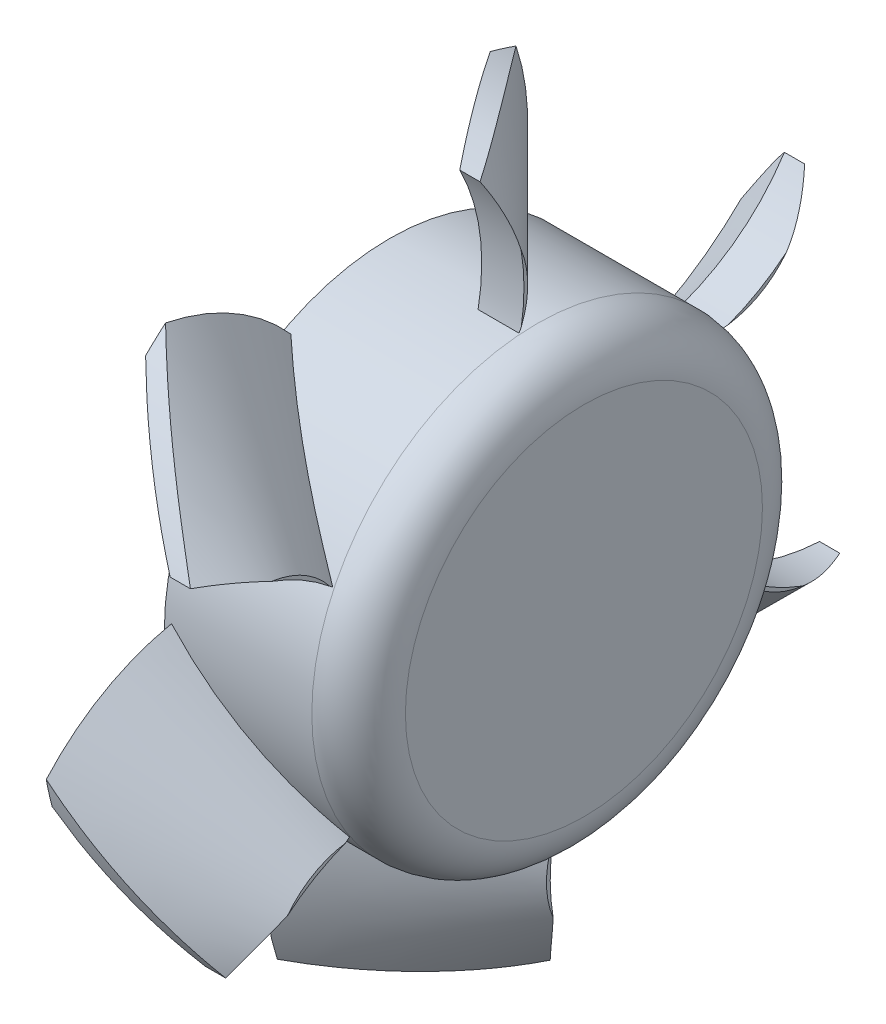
SolidWorks part; units mm, degrees
ref_plane "Front Plane" through (0, 0, 0) normal (0, 0, 1) x (1, 0, 0)
ref_plane "Top Plane" through (0, 0, 0) normal (0, 1, 0) x (1, 0, 0)
ref_plane "Right Plane" through (0, 0, 0) normal (1, 0, 0) x (0, 0, -1)
sketch "Sketch1" plane through (0, 0, 0) normal (1, 0, 0) x (0, 0, -1)
  circle A0 centre (0, 0) radius 12.2301
  dimension "D1" = 24.4602
extrude "Extrude1" add sketch "Sketch1" along normal blind 10.541
fillet "Fillet1" radius 2.54 1 edges at (10.541, 0, -12.2301)
ref_plane "Plane1" through (7.9993, 0, 0) normal (1, 0, 0) x (0, 0, -1)
ref_plane "Plane2" through (0, 12.2301, 0) normal (0, 1, 0) x (-1, 0, 0)
sketch "Sketch4" plane through (7.9993, 0, 0) normal (1, 0, 0) x (0, 0, -1)
  line L0 (0, -19.3421) -> (0, 19.3421) construction
  line L1 (5.715, -19.3421) -> (5.715, -18.4785)
  line L2 (-19.3421, 0) -> (19.3421, 0) construction
  line L3 (5.715, -19.3421) -> (5.715, 19.3421) construction
  arc A0 (-1.905, 19.2481) -> (-0.9111, 12.1961) centre (-11.6721, 14.2754) cw
  arc A1 (-11.0177, 5.3091) -> (-12.2228, 0.4222) centre (0, 0) ccw
  arc A2 (6.477, 18.2254) -> (6.477, 10.3742) centre (-5.3337, 14.2998) cw
  arc A3 (-10.1066, -6.8871) -> (-6.477, -10.3742) centre (0, 0) ccw
  arc A4 (-12.5452, 14.7219) -> (-17.6218, 7.9743) centre (0, 0) ccw
  arc A5 (15.7168, 11.2738) -> (10.1066, 6.8871) centre (6.5268, 17.2461) cw
  arc A6 (19.0222, 3.5035) -> (12.2228, -0.4222) centre (9.7171, 11.769) cw
  arc A7 (17.6218, -7.9743) -> (11.0177, -5.3091) centre (18.1989, 2.9706) cw
  arc A8 (12.5452, -14.7219) -> (5.7458, -10.7963) centre (15.0508, -2.5308) cw
  arc A9 (1.905, -19.2481) -> (0.9111, -12.1961) centre (11.6721, -14.2754) cw
  arc A10 (-6.477, -18.2254) -> (-6.477, -10.3742) centre (5.3337, -14.2998) cw
  arc A11 (-15.7168, -11.2738) -> (-10.1066, -6.8871) centre (-6.5268, -17.2461) cw
  arc A12 (-19.0222, -3.5035) -> (-12.2228, 0.4222) centre (-9.7171, -11.769) cw
  arc A13 (-17.6218, 7.9743) -> (-11.0177, 5.3091) centre (-18.1989, -2.9706) cw
  arc A14 (-12.5452, 14.7219) -> (-5.7458, 10.7963) centre (-15.0508, 2.5308) cw
  arc A15 (-19.0222, -3.5035) -> (-15.7168, -11.2738) centre (0, 0) ccw
  arc A16 (-6.477, -18.2254) -> (1.905, -19.2481) centre (0, 0) ccw
  arc A17 (12.5452, -14.7219) -> (17.6218, -7.9743) centre (0, 0) ccw
  arc A18 (19.0222, 3.5035) -> (15.7168, 11.2738) centre (0, 0) ccw
  arc A19 (6.477, 18.2254) -> (-1.905, 19.2481) centre (0, 0) ccw
  arc A20 (0.9111, -12.1961) -> (5.7458, -10.7963) centre (0, 0) ccw
  arc A21 (11.0177, -5.3091) -> (12.2228, -0.4222) centre (0, 0) ccw
  arc A22 (10.1066, 6.8871) -> (6.477, 10.3742) centre (0, 0) ccw
  arc A23 (-0.9111, 12.1961) -> (-5.7458, 10.7963) centre (0, 0) ccw
  dimension "D2" = 24.4602
  dimension "D7" = 12.221
  dimension "D10" = 10.9601
  dimension "D11" = 12.446
  dimension "D4" = 38.6842
  dimension "D6" = 18.2254
  dimension "D8" = 6.7477
  dimension "D9" = 10.3742
  dimension "D12" = 3.5035
  dimension "D13" = 11.4777
  dimension "D1" = 5.715
extrude "Extrude5" add sketch "Sketch4" against normal blind 7.62 contours A4 A13 A1 A12 A15 A11 A3 A10 A16 A9 A20 A8 A17 A7 A21 A6 A18 A5 A22 A2 A19 A0 A23 A14
chamfer "Chamfer8" distance 7.62 angle 45 1 edges at (7.9993, 14.2998, -7.1123)
chamfer "Chamfer10" distance 6.35 angle 40 1 edges at (0.3793, 15.8051, 0.8193)
chamfer "Chamfer14" distance 7.62 angle 45 1 edges at (7.9993, 13.3093, 8.8278)
chamfer "Chamfer15" distance 7.62 angle 45 1 edges at (7.9993, -0.9905, 15.9401)
chamfer "Chamfer16" distance 7.62 angle 45 1 edges at (7.9993, -14.2998, 7.1123)
chamfer "Chamfer17" distance 7.62 angle 45 1 edges at (7.9993, -13.3093, -8.8278)
chamfer "Chamfer18" distance 7.62 angle 45 1 edges at (7.9993, 0.9905, -15.9401)
chamfer "Chamfer22" distance 6.35 angle 40 1 edges at (0.3793, 8.6121, -13.2779)
chamfer "Chamfer23" distance 6.35 angle 40 1 edges at (0.3793, -7.193, -14.0972)
chamfer "Chamfer24" distance 6.35 angle 40 1 edges at (0.3793, -15.8051, -0.8193)
chamfer "Chamfer28" distance 6.35 angle 40 1 edges at (0.3793, -8.6121, 13.2779)
chamfer "Chamfer29" distance 6.35 angle 40 1 edges at (0.3793, 7.193, 14.0972)
